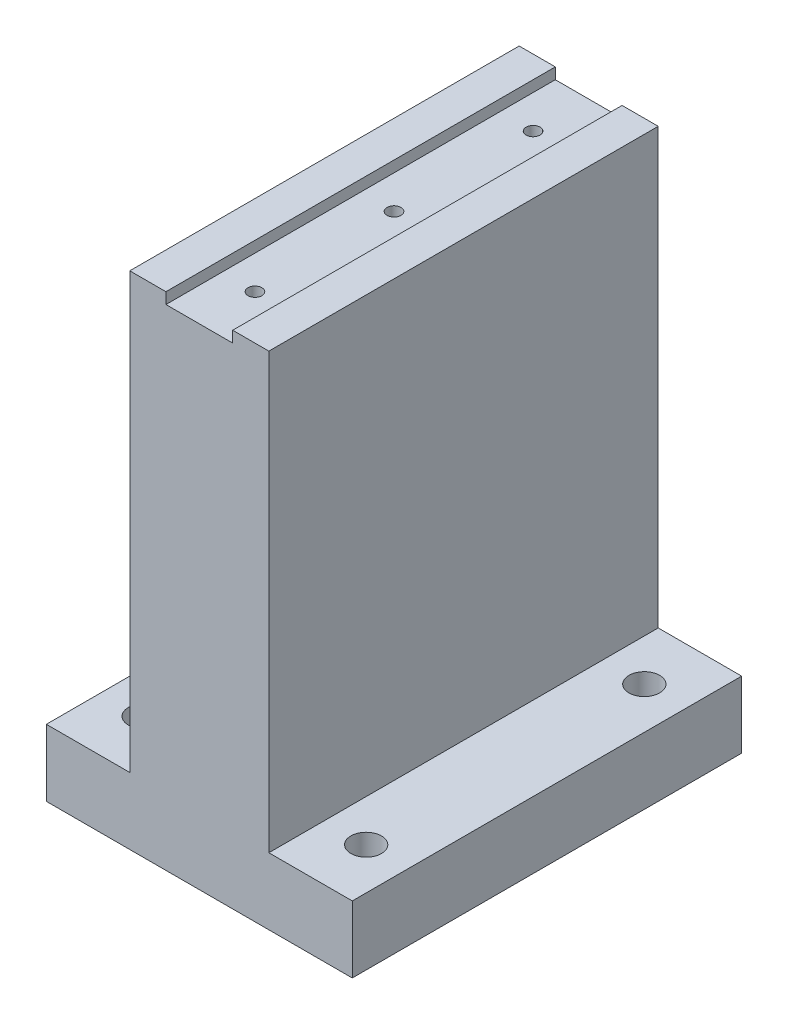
SolidWorks part; units mm, degrees
ref_plane "前视基准面" through (0, 0, 0) normal (0, 0, 1) x (1, 0, 0)
ref_plane "上视基准面" through (0, 0, 0) normal (0, 1, 0) x (1, 0, 0)
ref_plane "右视基准面" through (0, 0, 0) normal (1, 0, 0) x (0, 0, -1)
sketch "草图1" plane through (0, 0, 0) normal (0, 0, 1) x (1, 0, 0)
  line L0 (21.5, 88.1) -> (21.5, 90.1)
  line L1 (33.5, 88.1) -> (33.5, 90.1)
  line L2 (15, 12) -> (15, 90.1)
  line L3 (40, 12) -> (40, 90.1)
  line L4 (21.5, 88.1) -> (33.5, 88.1)
  line L5 (15, 90.1) -> (21.5, 90.1)
  line L6 (0, 0) -> (55, 0)
  line L7 (33.5, 90.1) -> (40, 90.1)
  line L8 (0, 0) -> (0, 12)
  line L9 (55, 0) -> (55, 12)
  line L10 (0, 12) -> (15, 12)
  line L11 (40, 12) -> (55, 12)
extrude "凸台-拉伸1" add sketch "草图1" along normal blind 70
sketch "草图2" plane through (0, 12, 0) normal (0, 1, 0) x (1, 0, 0)
  circle A0 centre (7.5, -10) radius 2.75
  circle A1 centre (47.5, -10) radius 2.75
  circle A2 centre (47.5, -60) radius 2.75
  circle A3 centre (7.5, -60) radius 2.75
extrude "切除-拉伸1" cut sketch "草图2" against normal blind 70
sketch "草图3" plane through (0, 88.1, 0) normal (0, 1, 0) x (1, 0, 0)
  circle A0 centre (27.5, -10) radius 1.25
  circle A1 centre (27.5, -35) radius 1.25
  circle A2 centre (27.5, -60) radius 1.25
extrude "切除-拉伸2" cut sketch "草图3" against normal blind 15
